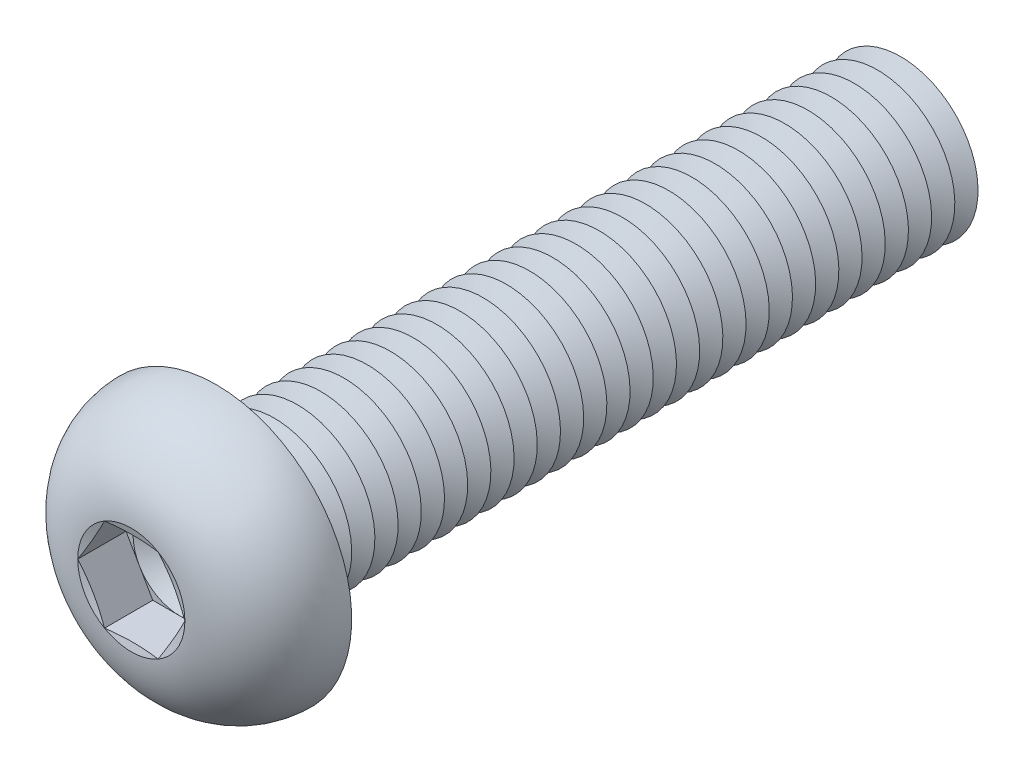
SolidWorks part; units mm, degrees
ref_plane "Front Plane" through (0, 0, 0) normal (0, 0, 1) x (1, 0, 0)
ref_plane "Top Plane" through (0, 0, 0) normal (0, 1, 0) x (1, 0, 0)
ref_plane "Right Plane" through (0, 0, 0) normal (1, 0, 0) x (0, 0, -1)
sketch "Sketch1" plane through (0, 0, 0) normal (1, 0, 0) x (0, 0, -1)
  line L0 (0, 5) -> (0, 8.75)
  line L3 (0, 5) -> (45, 5)
  line L4 (45, 5) -> (45, 0)
  line L5 (45, 0) -> (-5.5, 0) construction
  line L6 (-5.5, 0) -> (45, 0)
  line L7 (-5.5, 3.4641) -> (-5.5, 1.732) construction
  line L8 (-5.5, 1.732) -> (-5.5, 0)
  line L9 (-5.5, 3.4641) -> (-5.0359, 1.732)
  line L10 (-5.0359, 1.732) -> (-5.5, 1.732)
  line L11 (45, 0) -> (22.7481, 0) construction
  line L12 (0, 8.75) -> (-5.5, 8.75) construction
  arc A1 (0, 8.75) -> (-5.5, 3.4641) centre (0, 3.2457) ccw
  point P8 (45, 2.5)
  dimension "D1" = 17.5
  dimension "D2" = 10
  dimension "D3" = 5.5
  dimension "D4" = 6.9282
  dimension "D5" = 45
  dimension "D6" = 15
revolve "Revolve1" add sketch "Sketch1" angle 360 about L5
fillet "Fillet1" radius 0.75 1 edges at (0, 5, 0)
sketch "Sketch2" plane through (0, 0, 0) normal (1, 0, 0) x (0, 0, -1)
  line L0 (44.25, 5) -> (45.75, 5)
  line L1 (45, 5) -> (0.75, 5) construction
  line L2 (45.75, 5) -> (45, 3.701)
  line L3 (45, -5) -> (45, 5) construction
  line L4 (45, 3.701) -> (44.25, 5)
  dimension "D1" = 1.5
revolve "Cut-Revolve1" cut sketch "Sketch2" angle 360 about axis through (0, 0, -45) along (0, 0, -1)
pattern_linear "LPattern1" count 30 spacing 1.5 along (0, 0, 1) of "Cut-Revolve1"
sketch "Sketch3" plane through (0, 0, 5.5) normal (0, 0, 1) x (1, 0, 0)
  line L7 (1.732, 3) -> (-1.7321, 3)
  line L8 (-1.7321, 3) -> (-3.4641, 0)
  line L9 (-3.4641, 0) -> (-1.732, -3)
  line L10 (-1.732, -3) -> (1.732, -3)
  line L11 (1.732, -3) -> (3.4641, 0)
  line L12 (3.4641, 0) -> (1.732, 3)
  circle A0 centre (0, 0) radius 3 construction
  circle A3 centre (0, 0) radius 3.4641 construction
extrude "Cut-Extrude1" cut sketch "Sketch3" against normal blind 3.12
sketch "Sketch4" plane through (0, 0, 2.38) normal (0, 0, 1) x (1, 0, 0)
  line L1 (1.732, 3) -> (-1.7321, 3) construction
  circle A0 centre (0, 0) radius 3
extrude "Cut-Extrude2" cut sketch "Sketch4" against normal through all draft 60
